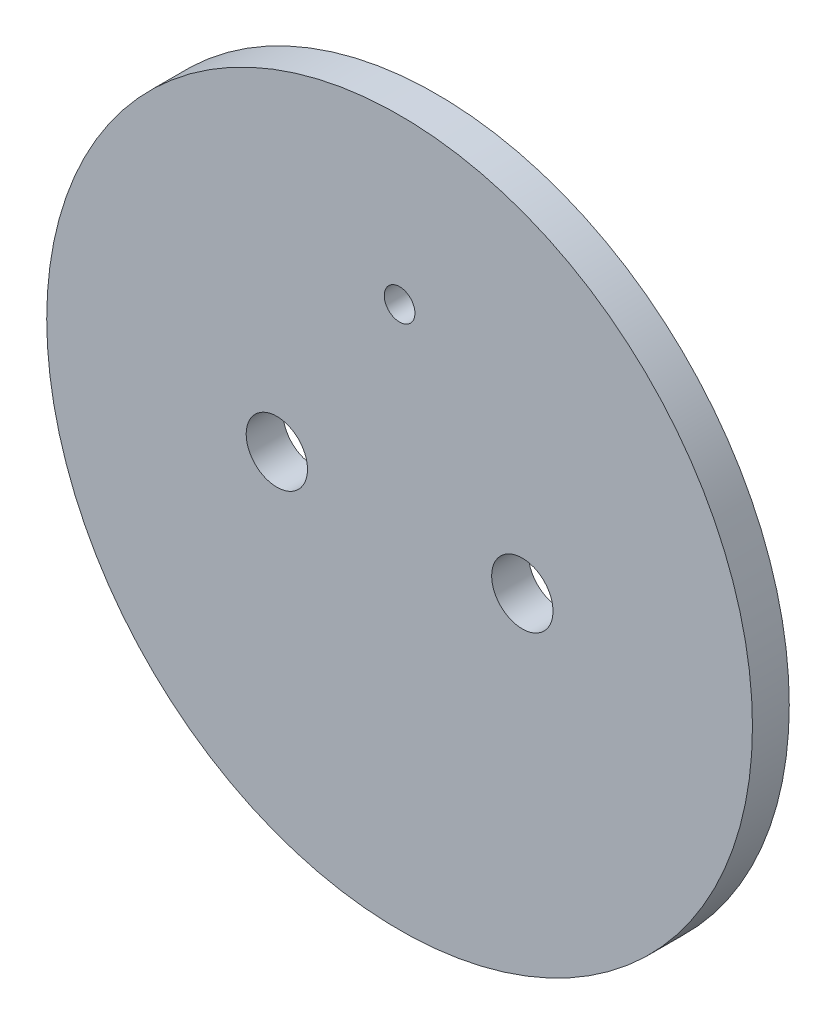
SolidWorks part; units mm, degrees
ref_plane "Front Plane" through (0, 0, 0) normal (0, 0, 1) x (1, 0, 0)
ref_plane "Top Plane" through (0, 0, 0) normal (0, 1, 0) x (1, 0, 0)
ref_plane "Right Plane" through (0, 0, 0) normal (1, 0, 0) x (0, 0, -1)
sketch "Sketch1" plane through (0, 0, 0) normal (0, 0, 1) x (1, 0, 0)
  circle A0 centre (0, 0) radius 36.5125
  dimension "D1" = 73.025
extrude "Extrude1" add sketch "Sketch1" along normal blind 3.81
sketch "Sketch2" plane through (0, 0, 0) normal (0, 0, 1) x (1, 0, 0)
  circle A0 centre (0, 19.558) radius 1.5875
  circle A1 centre (12.7, 0) radius 3.175
  circle A2 centre (-12.7, 0) radius 3.175
  dimension "D1" = 3.175
  dimension "D3" = 6.35
  dimension "D4" = 6.35
  dimension "D2" = 19.558
  dimension "D5" = 12.7
  dimension "D6" = 12.7
extrude "Cut-Extrude1" cut sketch "Sketch2" along normal through all
